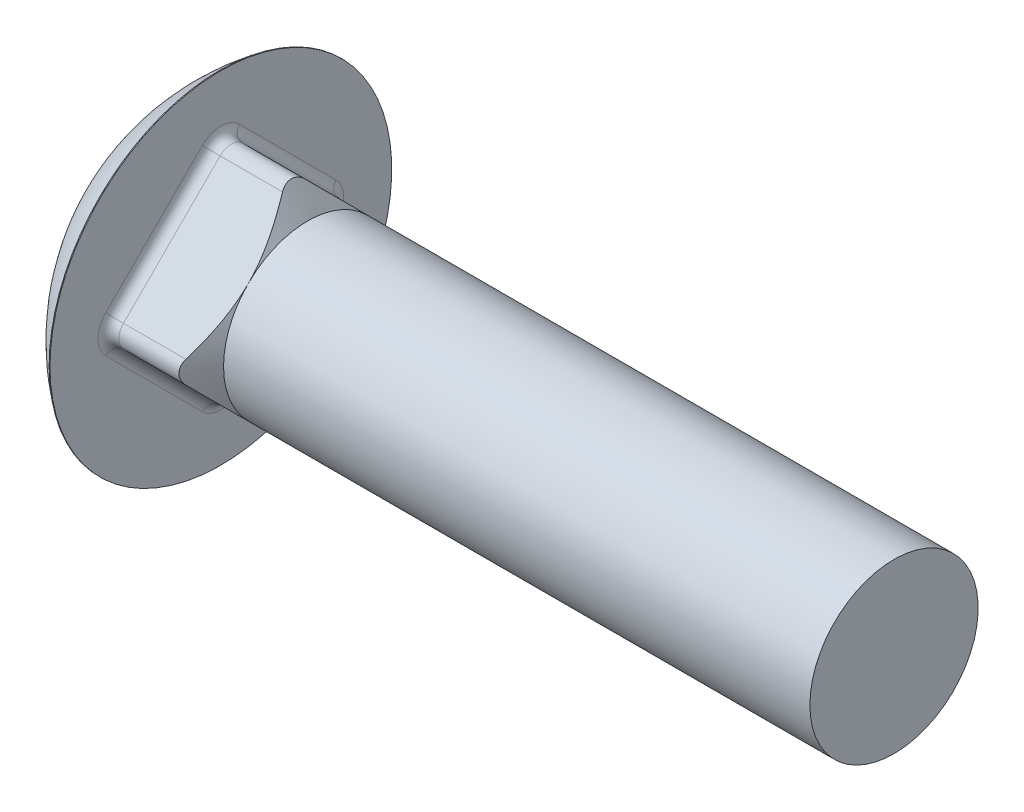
SolidWorks part; units mm, degrees
ref_plane "Plane1" through (0, 0, 0) normal (0, 0, 1) x (1, 0, 0)
ref_plane "Plane2" through (0, 0, 0) normal (0, 1, 0) x (1, 0, 0)
ref_plane "Plane3" through (0, 0, 0) normal (1, 0, 0) x (0, 0, -1)
sketch "BodySke" plane through (0, 0, 0) normal (0, 0, 1) x (1, 0, 0)
  line L0 (0, 0) -> (114.7064, 0)
  line L1 (13.1064, 12.7) -> (114.7064, 12.7)
  line L2 (13.1064, -12.7) -> (114.7064, -12.7) construction
  line L3 (114.7064, 12.7) -> (114.7064, 0)
  line L4 (13.1064, 25.7937) -> (12.9794, 25.7937)
  line L5 (13.1064, -25.7937) -> (12.9794, -25.7937) construction
  line L6 (0, 0) -> (123.825, 0) construction
  line L8 (13.1064, 25.7937) -> (13.1064, 12.7)
  arc A0 (12.9794, 25.7937) -> (0, 0) centre (32.1194, 0) ccw
  point P11 (13.1064, 12.7)
  point P14 (95.25, 66.675)
  dimension "D1" = 0.127
  dimension "Diameter" = 25.4
  dimension "Length" = 101.6
  dimension "Head_dia" = 51.5874
  dimension "Head_ht" = 13.1064
revolve "Base-Revolve" add sketch "BodySke" angle 360 about L6
sketch "Sketch2" plane through (13.1064, 0, 0) normal (1, 0, 0) x (0, -0.7071, -0.7071)
  line L1 (10.3124, -12.7) -> (-10.3124, -12.7)
  line L2 (12.7, -10.3124) -> (12.7, 10.3124)
  line L3 (10.3124, 12.7) -> (-10.3124, 12.7)
  line L4 (-12.7, -10.3124) -> (-12.7, 10.3124)
  arc A0 (-12.7, 10.3124) -> (-10.3124, 12.7) centre (-10.3124, 10.3124) cw
  arc A1 (12.7, 10.3124) -> (10.3124, 12.7) centre (10.3124, 10.3124) ccw
  arc A2 (10.3124, -12.7) -> (12.7, -10.3124) centre (10.3124, -10.3124) ccw
  arc A3 (-12.7, -10.3124) -> (-10.3124, -12.7) centre (-10.3124, -10.3124) ccw
  dimension "Neck_corner_radius" = 2.3876
  dimension "D1" = 12.7
  dimension "Neck_width" = 25.4
  dimension "D2" = 25.4
  dimension "D3" = 12.7
extrude "Neck" add sketch "Sketch2" along normal blind 13.1064
fillet "NeckFillet" radius 1.5748 8 edges at (13.1064, 8.9803, -8.9803) (13.1064, -8.9803, -8.9803) (13.1064, -8.9803, 8.9803) (13.1064, 8.9803, 8.9803) (13.1064, 16.9715, 0) (13.1064, 0, 16.9715) (13.1064, -16.9715, 0) (13.1064, 0, -16.9715)
sketch "Sketch3" plane through (0, 0, 0) normal (0, 0, 1) x (1, 0, 0)
  line L0 (26.2128, 12.7) -> (13.1064, 35.401)
  line L1 (13.1064, 35.401) -> (13.1064, 38.4937)
  line L2 (13.1064, 38.4937) -> (38.9128, 38.4937)
  line L3 (38.9128, 38.4937) -> (38.9128, 12.7)
  line L4 (26.2128, 12.7) -> (38.9128, 12.7)
  line L5 (0, 0) -> (57.7043, 0) construction
  line L6 (26.2128, 0) -> (14.6812, 0) construction
  line L7 (28.321, 15.875) -> (28.321, -19.05) construction
  line L8 (13.1064, -25.7937) -> (13.1064, 25.7937) construction
  line L10 (82.9564, 22.225) -> (82.9564, -15.875) construction
  line L11 (114.7064, -12.7) -> (114.7064, 12.7) construction
  dimension "D1" = 12.7
  dimension "D2" = 26.2128
  dimension "D3" = 120
  dimension "D4" = 12.7
  dimension "D5" = 38.4937
  dimension "Advance" = 2.1082
  dimension "Thread_nom" = 31.75
revolve "Cut-Revolve1" cut sketch "Sketch3" angle 360 about L5
sketch "ThdSchSke" plane through (0, 0, 0) normal (0, 0, 1) x (1, 0, 0)
  line L0 (82.9564, -10.8077) -> (81.6314, -12.7)
  line L1 (82.9564, -10.8077) -> (84.2814, -12.7)
  line L2 (84.2814, -12.7) -> (84.2814, -15.875)
  line L3 (-3.175, 0) -> (5.5369, 0) construction
  line L4 (28.2455, 0) -> (22.1474, 0) construction
  line L5 (84.2814, -15.875) -> (81.6314, -15.875)
  line L6 (81.6314, -15.875) -> (81.6314, -12.7)
  point P6 (0, 0)
  dimension "Thread_minor" = 21.6154
  dimension "Diameter" = 25.4
  dimension "Start" = 82.9564
  dimension "SideAngle" = 55
  dimension "VeeAngle" = 70
  dimension "Overcut" = 31.75
revolve "ThreadSchematic" [suppressed] cut sketch "ThdSchSke" angle 360 about L3
pattern_linear "ThdSchPat" [suppressed]
equation "\"D1@Sketch2\" = \"Neck_width@Sketch2\" / 2"
equation "\"D2@Sketch2\" = \"Neck_width@Sketch2\""
equation "\"D3@Sketch2\" = \"D2@Sketch2\" / 2"
equation "\"D1@Sketch3\" = \"Diameter@BodySke\"/2"
equation "\"D2@Sketch3\" = \"Head_ht@BodySke\"+\"Neck_ht@Neck\""
equation "\"D5@Sketch3\" = \"Head_dia@BodySke\"/2+.5"
equation "\"Thread_length@ThreadCosmetic\" = ((sgn( (\"Length@BodySke\" - \"Advance@Sketch3\" - \"Neck_ht@Neck\" ) - \"Thread_nom@Sketch3\" )-1)*( (\"Length@BodySke\" - \"Advance@Sketch3\" - \"Neck_ht@Neck\" ) - \"Thread_nom@Sk"
equation "\"Thread_minor@ThdSchSke\" = \"Thread_minor@ThreadCosmetic\""
equation "\"Diameter@ThdSchSke\" = \"Diameter@BodySke\""
equation "\"Overcut@ThdSchSke\" = \"Diameter@BodySke\" * 1.25"
equation "\"Start@ThdSchSke\" = \"Head_ht@BodySke\" + \"Length@BodySke\" - \"Thread_length@ThreadCosmetic\"  '---Non-countersunk---"
equation "\"Num_threads@ThdSchPat\" = int( \"Thread_length@ThreadCosmetic\" / \"Advance@Sketch3\" + 0.999 )  + 1"
equation "\"Advance@ThdSchPat\" = \"Thread_length@ThreadCosmetic\" /  (\"Num_threads@ThdSchPat\" - 1) 'relax it"
